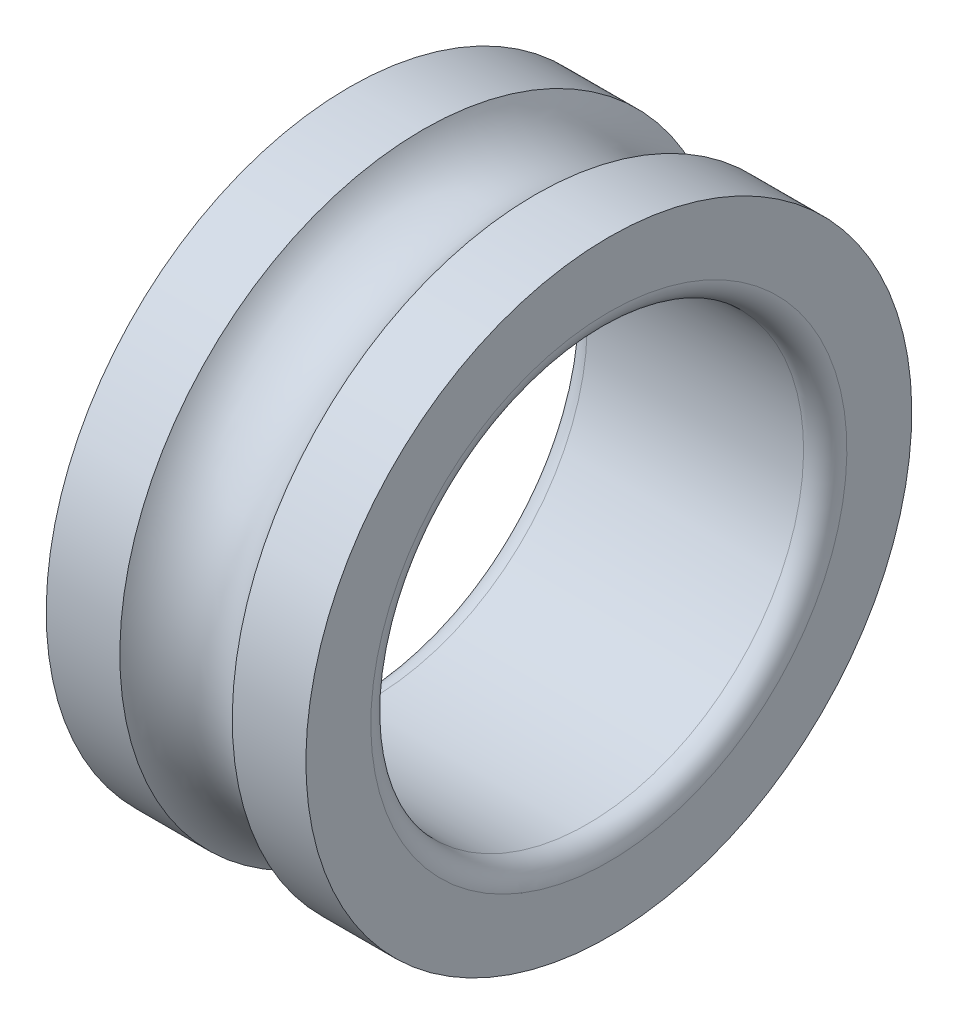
SolidWorks part; units mm, degrees
ref_plane "Plan1" through (0, 0, 0) normal (0, 0, 1) x (1, 0, 0)
ref_plane "Plan2" through (0, 0, 0) normal (0, 1, 0) x (1, 0, 0)
ref_plane "Plan3" through (0, 0, 0) normal (1, 0, 0) x (0, 0, -1)
sketch "Esquisse1" plane through (0, 0, 0) normal (0, 0, 1) x (1, 0, 0)
  line L0 (-30, 87.5) -> (70, 87.5) construction
  line L1 (-6, 97.5) -> (4, 97.5)
  line L2 (-7, 98.5) -> (-7, 101.5)
  line L3 (1.5981, 101.5) -> (5, 101.5)
  line L4 (5, 98.5) -> (5, 101.5)
  line L6 (20, 87.5) -> (-7, 87.5) construction
  line L7 (-7, 101.5) -> (-3.5981, 101.5)
  arc A0 (5, 98.5) -> (4, 97.5) centre (4, 98.5) cw
  arc A3 (-6, 97.5) -> (-7, 98.5) centre (-6, 98.5) cw
  arc A4 (-3.5981, 101.5) -> (1.5981, 101.5) centre (-1, 103) ccw
  point P18 (-7, 97.5)
  dimension "D5" = 1
  dimension "D7" = 6
  dimension "D3" = 10
  dimension "D6" = 4
  dimension "D8" = 5.5
  dimension "D9" = 6
revolve "Base-Révolution" add sketch "Esquisse1" angle 360 about L6
